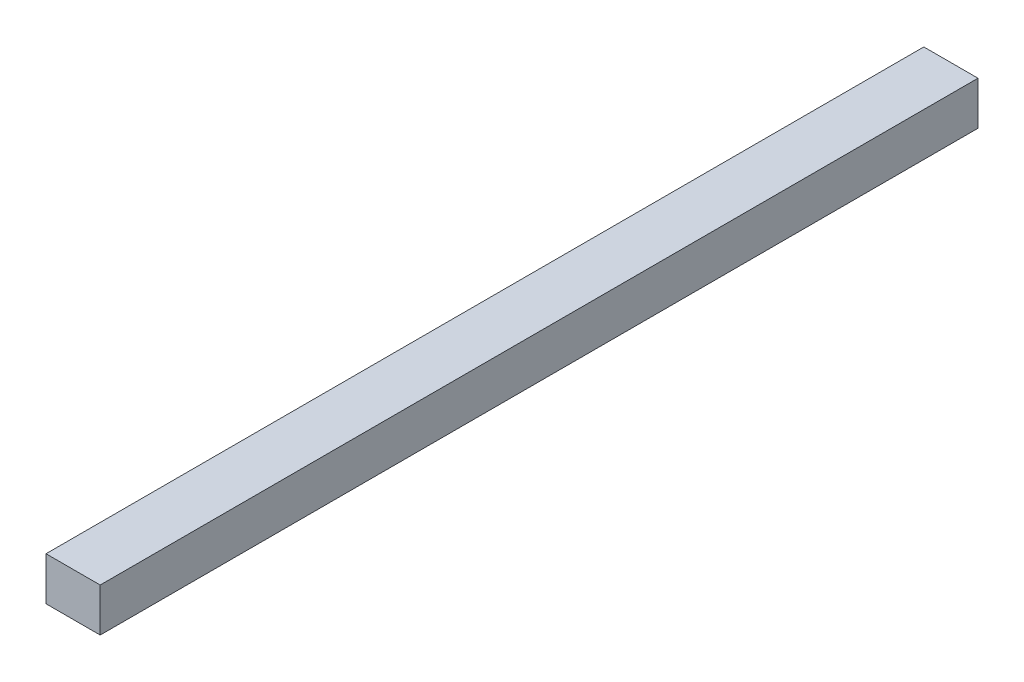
SolidWorks part; units mm, degrees
ref_plane "Plan de face" through (0, 0, 0) normal (0, 0, 1) x (1, 0, 0)
ref_plane "Plan de dessus" through (0, 0, 0) normal (0, 1, 0) x (1, 0, 0)
ref_plane "Plan de droite" through (0, 0, 0) normal (1, 0, 0) x (0, 0, -1)
sketch "Esquisse1" plane through (0, 0, 0) normal (0, 0, 1) x (1, 0, 0)
  line L1 (0, 0) -> (5, 0)
  line L2 (0, 0) -> (0, 4)
  line L3 (0, 4) -> (5, 4)
  line L4 (5, 0) -> (5, 4)
  dimension "D1" = 5
  dimension "D2" = 4
extrude "Extrusion1" add sketch "Esquisse1" along normal blind 81
